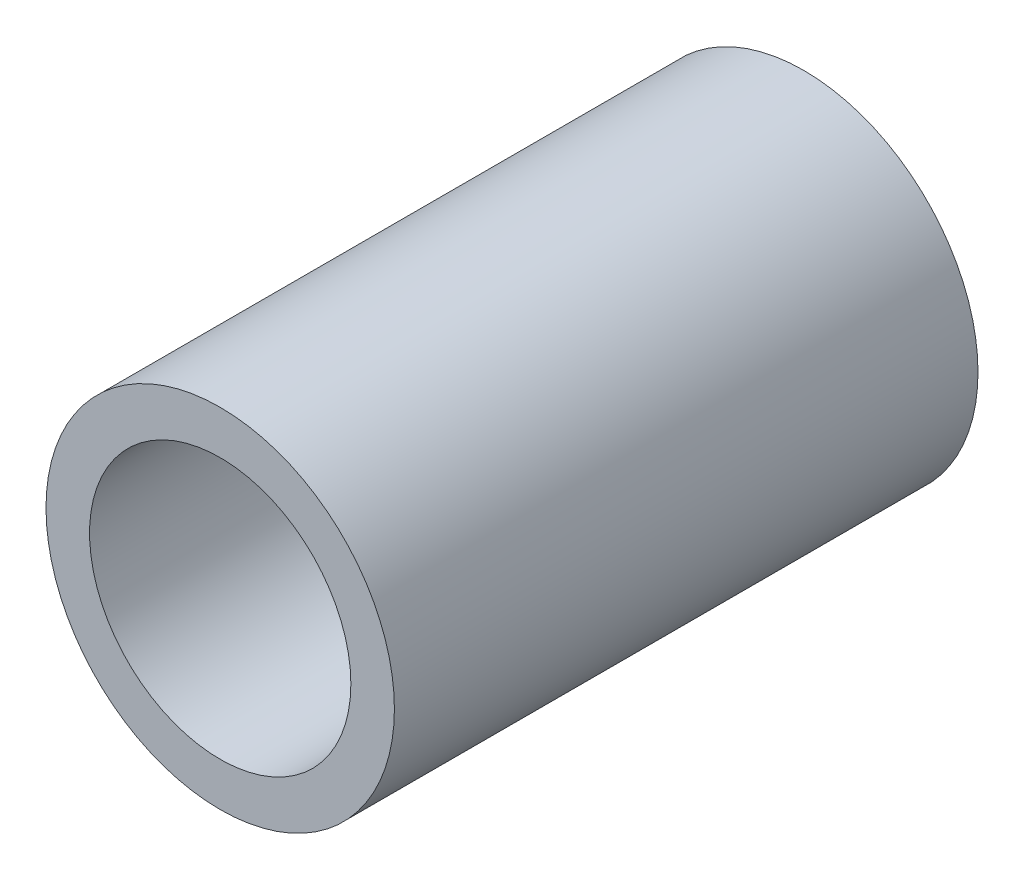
SolidWorks part; units mm, degrees
ref_plane "Plan de face" through (0, 0, 0) normal (0, 0, 1) x (1, 0, 0)
ref_plane "Plan de dessus" through (0, 0, 0) normal (0, 1, 0) x (1, 0, 0)
ref_plane "Plan de droite" through (0, 0, 0) normal (1, 0, 0) x (0, 0, -1)
sketch "Esquisse1" plane through (0, 0, 0) normal (0, 0, 1) x (1, 0, 0)
  circle A0 centre (0, 0) radius 20
  circle A1 centre (0, 0) radius 15
  dimension "D1" = 40
  dimension "D2" = 30
extrude "Extrusion1" add sketch "Esquisse1" along normal blind 67
